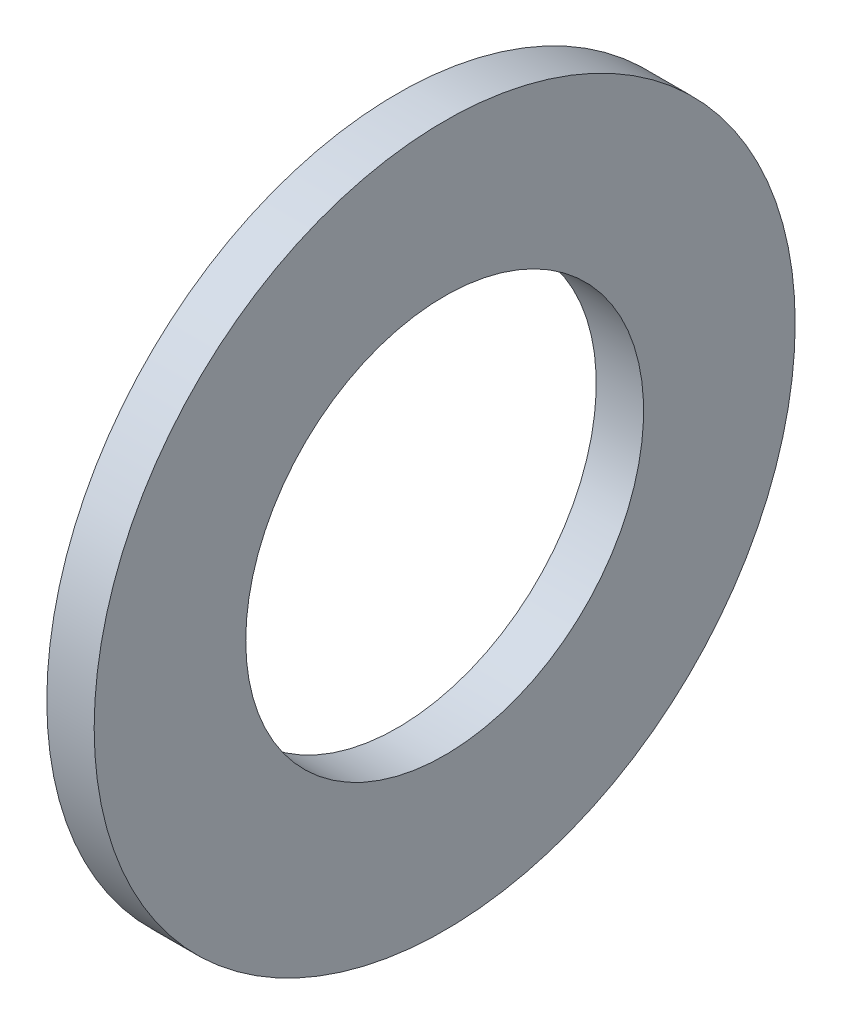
SolidWorks part; units mm, degrees
ref_plane "Plan1" through (0, 0, 0) normal (0, 0, 1) x (1, 0, 0)
ref_plane "Plan2" through (0, 0, 0) normal (0, 1, 0) x (1, 0, 0)
ref_plane "Plan3" through (0, 0, 0) normal (1, 0, 0) x (0, 0, -1)
sketch "Esquisse1" plane through (0, 0, 0) normal (0, 0, 1) x (1, 0, 0)
  line L0 (50, 0) -> (-50, 0) construction
  line L1 (0, 10.5) -> (2.5, 10.5)
  line L2 (0, 10.5) -> (0, 18.5)
  line L3 (0, 18.5) -> (2.5, 18.5)
  line L4 (2.5, 10.5) -> (2.5, 18.5)
  line L5 (0, 0) -> (10, 0) construction
  dimension "D1" = 2.5
  dimension "D2" = 8
  dimension "D3" = 10.5
revolve "Base-Révolution" add sketch "Esquisse1" angle 360 about L5
